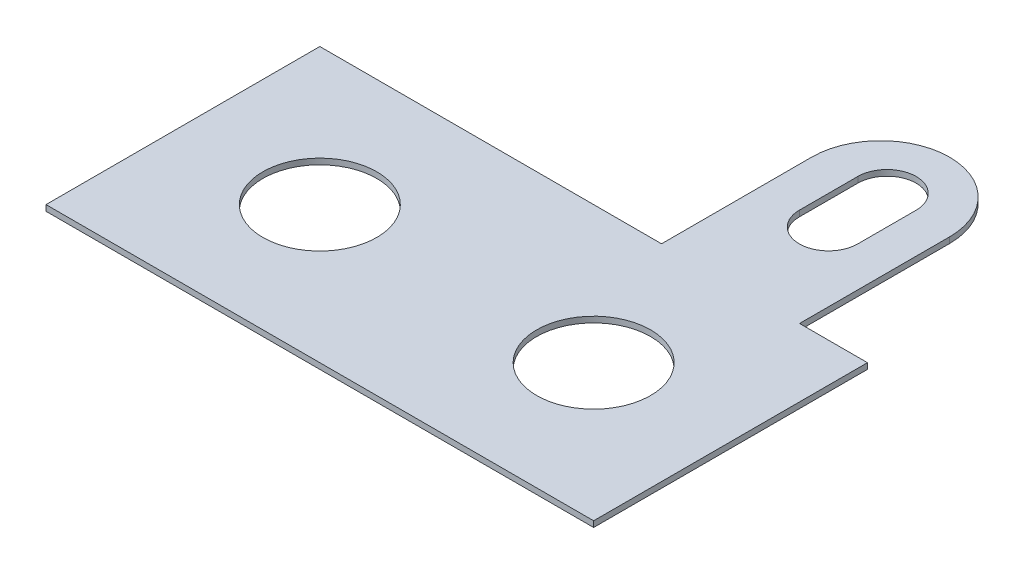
SolidWorks part; units mm, degrees
ref_plane "Front Plane" through (0, 0, 0) normal (0, 0, 1) x (1, 0, 0)
ref_plane "Top Plane" through (0, 0, 0) normal (0, 1, 0) x (1, 0, 0)
ref_plane "Right Plane" through (0, 0, 0) normal (1, 0, 0) x (0, 0, -1)
sketch "Sketch1" plane through (0, 0, 0) normal (0, 1, 0) x (1, 0, 0)
  line L0 (0, 0) -> (0, 14.9391) construction
  line L1 (-9.525, -4.7625) -> (9.525, -4.7625)
  line L2 (-9.525, -4.7625) -> (-9.525, 4.7625)
  line L3 (-9.525, 4.7625) -> (9.525, 4.7625)
  line L4 (9.525, -4.7625) -> (9.525, 4.7625)
  line L5 (-9.525, -4.7625) -> (9.525, 4.7625) construction
  line L6 (-9.525, 4.7625) -> (9.525, -4.7625) construction
  line L7 (0, 0) -> (-34.5199, 0) construction
  circle A0 centre (-4.7625, 0) radius 1.9812
  circle A1 centre (4.7625, 0) radius 1.9812
  point P0 (0, 0)
  dimension "D3" = 3.9624
  dimension "D4" = 9.525
  dimension "D1" = 9.525
  dimension "D2" = 19.05
extrude "Boss-Extrude1" add sketch "Sketch1" along normal blind 0.2032
sketch "Sketch2" plane through (0, 0, 0) normal (0, -1, 0) x (1, 0, 0)
  line L0 (4.7625, 0) -> (4.7625, -10.2037) construction
  line L1 (2.3622, -4.7625) -> (2.3622, -9.9822)
  line L2 (9.525, -4.7625) -> (-9.525, -4.7625) construction
  line L3 (7.1628, -4.7625) -> (7.1628, -9.9822)
  line L4 (4.7625, -10.2037) -> (4.7625, -8.1717) construction
  line L5 (3.7465, -10.2037) -> (3.7465, -8.1717)
  line L6 (5.7785, -10.2037) -> (5.7785, -8.1717)
  arc A0 (2.3622, -9.9822) -> (7.1628, -9.9822) centre (4.7625, -9.9822) ccw
  arc A1 (3.7465, -10.2037) -> (5.7785, -10.2037) centre (4.7625, -10.2037) ccw
  arc A2 (5.7785, -8.1717) -> (3.7465, -8.1717) centre (4.7625, -8.1717) ccw
  point P10 (4.7625, -9.1877)
  dimension "D3" = 7.62
  dimension "D5" = 2.032
  dimension "D1" = 4.8006
  dimension "D2" = 4.8006
  dimension "D4" = 2.032
  dimension "D6" = 4.4252
extrude "Boss-Extrude2" add sketch "Sketch2" against normal blind 0.2032 contours L1 A0 L3 A2 L6 A1 L5 M5
